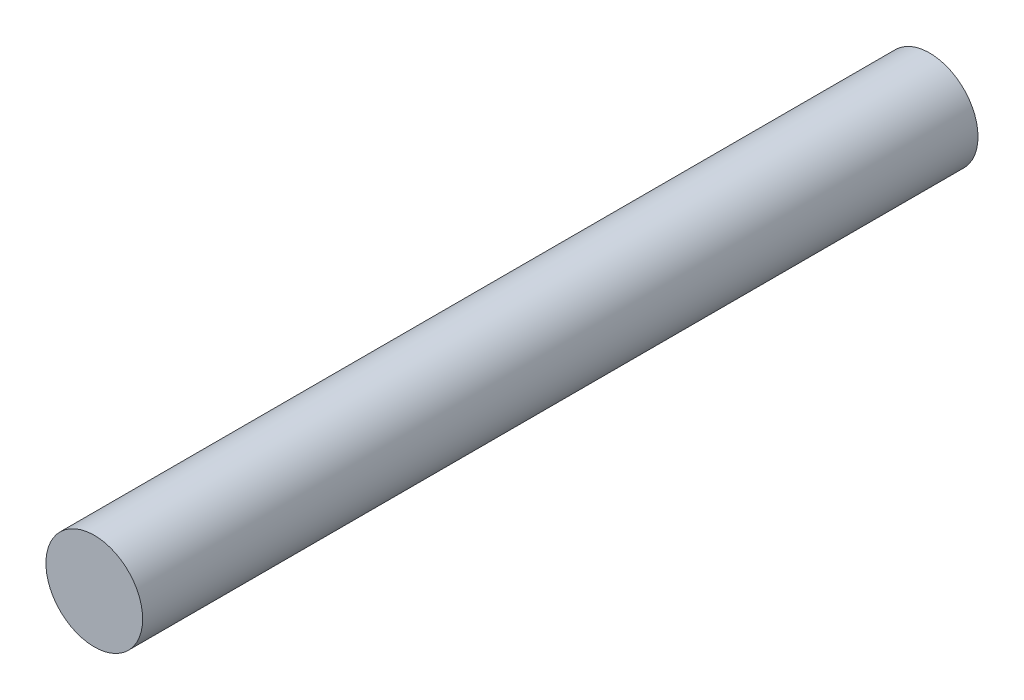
SolidWorks part; units mm, degrees
ref_plane "Front Plane" through (0, 0, 0) normal (0, 0, 1) x (1, 0, 0)
ref_plane "Top Plane" through (0, 0, 0) normal (0, 1, 0) x (1, 0, 0)
ref_plane "Right Plane" through (0, 0, 0) normal (1, 0, 0) x (0, 0, -1)
sketch "Sketch1" plane through (0, 0, 0) normal (0, 0, 1) x (1, 0, 0)
  circle A0 centre (0, 0) radius 1.1
extrude "Boss-Extrude1" add sketch "Sketch1" along normal blind 19
